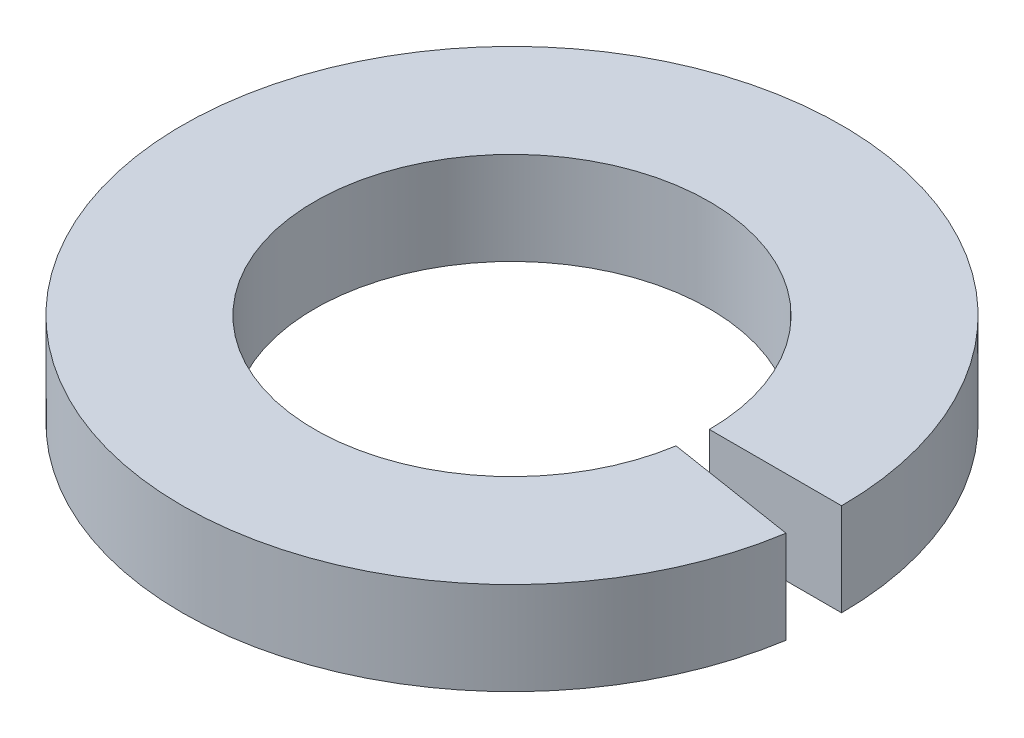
SolidWorks part; units mm, degrees
ref_plane "Front" through (0, 0, 0) normal (0, 0, 1) x (1, 0, 0)
ref_plane "Top" through (0, 0, 0) normal (0, 1, 0) x (1, 0, 0)
ref_plane "Right" through (0, 0, 0) normal (1, 0, 0) x (0, 0, -1)
sketch "Sketch1" plane through (0, 0, 0) normal (0, 0, 1) x (1, 0, 0)
  line L0 (0, -59.69) -> (0, 60.8838) construction
  line L1 (2.54, 0) -> (2.54, 1.1938)
  line L2 (2.54, 1.1938) -> (4.2418, 1.1938)
  line L3 (4.2418, 1.1938) -> (4.2418, 0)
  line L4 (4.2418, 0) -> (2.54, 0)
revolve "Base-Revolve" add sketch "Sketch1" angle 351 about L0
